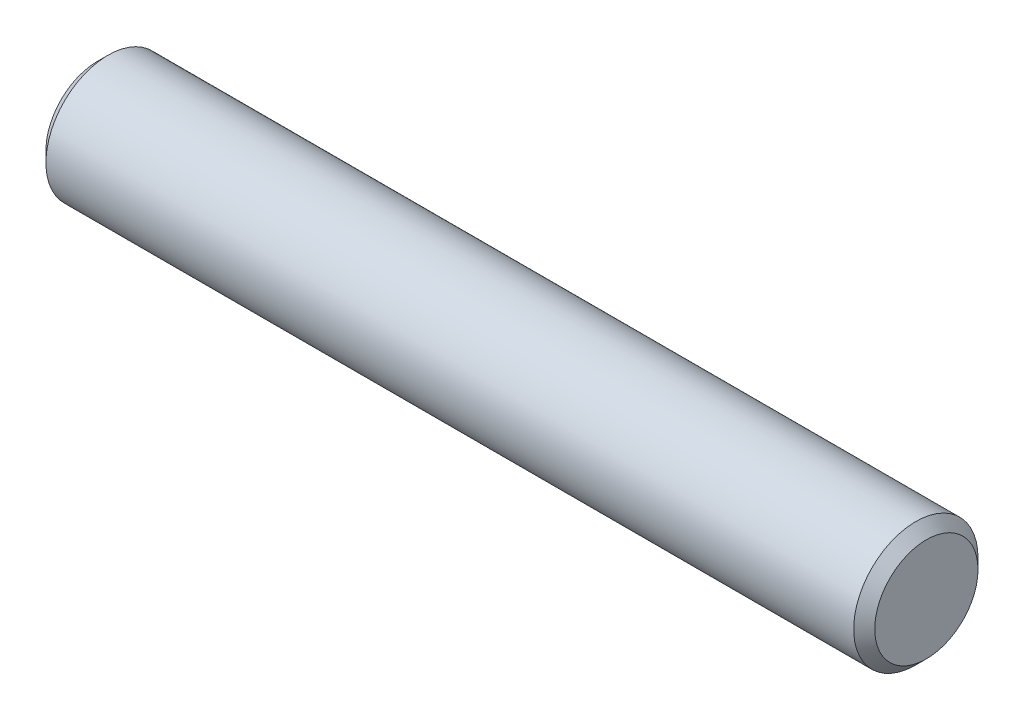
SolidWorks part; units mm, degrees
ref_plane "Front" through (0, 0, 0) normal (0, 0, 1) x (1, 0, 0)
ref_plane "Top" through (0, 0, 0) normal (0, 1, 0) x (1, 0, 0)
ref_plane "Right" through (0, 0, 0) normal (1, 0, 0) x (0, 0, -1)
sketch "xsection" plane through (0, 0, 0) normal (1, 0, 0) x (0, 0, -1)
  circle A0 centre (0, 0) radius 1.5
  dimension "diameter" = 3
extrude "extrusion" add sketch "xsection" along normal mid plane 20
chamfer "Chamfer1" distance 0.254 angle 45 2 edges at (-10, 0, -1.5) (10, 0, -1.5)
